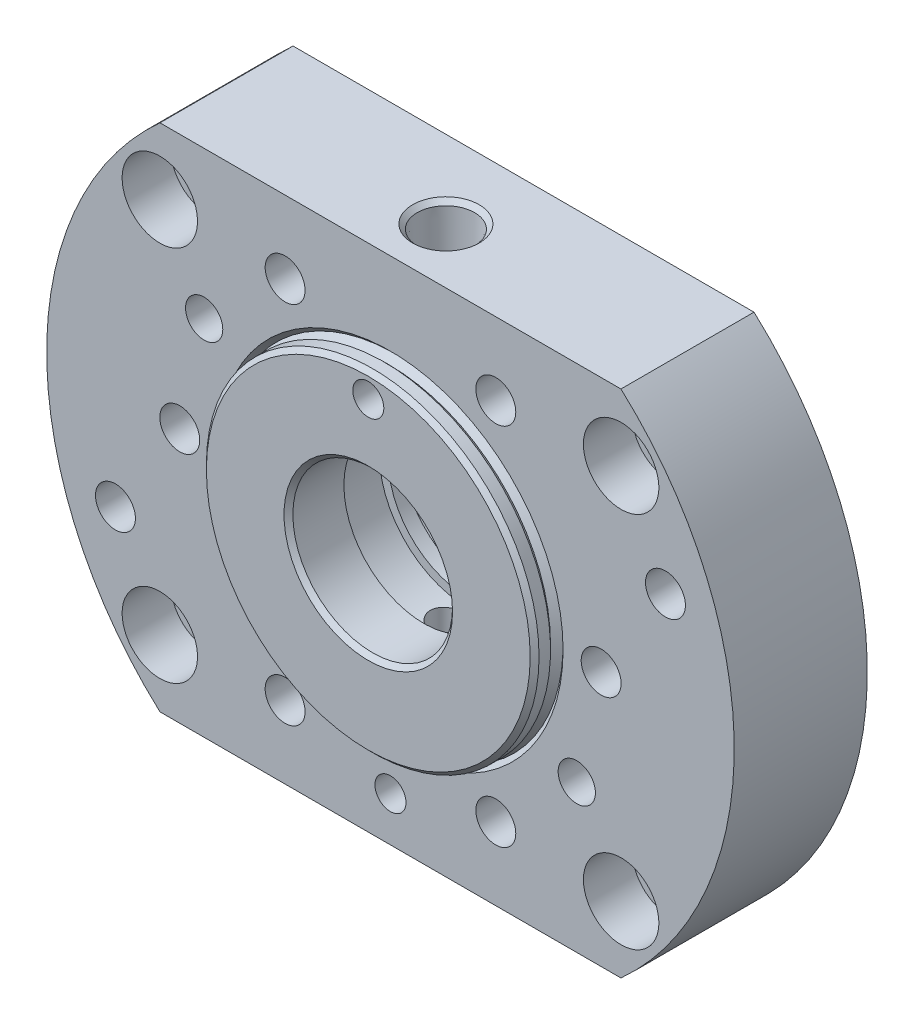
SolidWorks part; units mm, degrees
ref_plane "前视基准面" through (0, 0, 0) normal (0, 0, 1) x (1, 0, 0)
ref_plane "上视基准面" through (0, 0, 0) normal (0, 1, 0) x (1, 0, 0)
ref_plane "右视基准面" through (0, 0, 0) normal (1, 0, 0) x (0, 0, -1)
sketch "草图1" plane through (0, 0, 0) normal (1, 0, 0) x (0, 0, -1)
  line L0 (-1, 18) -> (-1, 35)
  line L1 (-1, 35) -> (0, 35)
  line L2 (0, 35) -> (0, 77.5)
  line L3 (0, 77.5) -> (-30, 77.5)
  line L4 (-30, 77.5) -> (-30, 38.9142)
  line L5 (-31.4142, 37.5) -> (-35, 37.5)
  line L6 (-35, 37.5) -> (-35, 18)
  line L7 (-35, 18) -> (-22.5, 18)
  line L8 (-22.5, 18) -> (-22.5, 20)
  line L9 (-22.5, 20) -> (-12.5, 20)
  line L10 (-12.5, 20) -> (-12.5, 18)
  line L11 (-12.5, 18) -> (-9.3, 18)
  line L12 (-9.3, 18) -> (-9.3, 21)
  line L13 (-9.3, 21) -> (-4.5, 21)
  line L14 (-4.5, 21) -> (-4.5, 18)
  line L15 (-4.5, 18) -> (-1, 18)
  line L16 (0, 0) -> (-40.0004, 0) construction
  line L17 (-17.5, 20) -> (-17.5, 6.4287) construction
  line L18 (-30, 38.9142) -> (-28.9393, 37.8536)
  line L19 (-28.9393, 37.8536) -> (-30.3536, 36.4393)
  line L20 (-30.3536, 36.4393) -> (-31.4142, 37.5)
  line L21 (-30, 37.5) -> (-39.6979, 47.1979) construction
  line L22 (-30, 38.9142) -> (-30, 37.5) construction
  line L23 (-30, 37.5) -> (-31.4142, 37.5) construction
  dimension "D1" = 36
  dimension "D2" = 40
  dimension "D3" = 42
  dimension "D4" = 155
  dimension "D5" = 75
  dimension "D6" = 70
  dimension "D7" = 5
  dimension "D8" = 10
  dimension "D9" = 1
  dimension "D10" = 4.8
  dimension "D11" = 3.5
  dimension "D12" = 35
  dimension "D13" = 12.5
  dimension "D14" = 2
  dimension "D15" = 1.5
  dimension "D16" = 45
revolve "旋转1" add sketch "草图1" angle 360 about L16
sketch "草图2" plane through (0, 0, 0) normal (0, 0, -1) x (-1, 0, 0)
  line L0 (0, 0) -> (0, -96.6864) construction
  line L1 (2.5, -27.7392) -> (-2.5, -27.7392)
  line L2 (2.5, -27.7392) -> (2.5, -84.8211)
  line L3 (2.5, -84.8211) -> (-2.5, -84.8211)
  line L4 (-2.5, -27.7392) -> (-2.5, -84.8211)
  dimension "D1" = 5
extrude "切除-拉伸1" cut sketch "草图2" against normal up to surface (1 mm away)
sketch "草图3" plane through (0, 0, 0) normal (0, 0, 1) x (1, 0, 0)
  line L0 (0, 0) -> (62.0525, 0) construction
  line L1 (-96.045, 96.6235) -> (66.8627, 96.6235)
  line L2 (-96.045, 96.6235) -> (-96.045, 57.5)
  line L3 (-96.045, 57.5) -> (66.8627, 57.5)
  line L4 (66.8627, 96.6235) -> (66.8627, 57.5)
  line L5 (66.8627, -96.6235) -> (66.8627, -57.5)
  line L6 (-96.045, -57.5) -> (66.8627, -57.5)
  line L7 (-96.045, -96.6235) -> (-96.045, -57.5)
  line L8 (-96.045, -96.6235) -> (66.8627, -96.6235)
  dimension "D1" = 115
extrude "切除-拉伸3" cut sketch "草图3" along normal through all
sketch "草图4" plane through (0, 0, 0) normal (1, 0, 0) x (0, 0, -1)
  line L0 (-17.5, 70.5589) -> (-17.5, -52.7009) construction
  line L1 (-30, 57.5) -> (-30, -57.5) construction
  line L2 (-12.5, 25.5) -> (-12.5, 42.5)
  line L3 (-12.5, 42.5) -> (-11.4688, 42.5)
  line L4 (-17.5, 57.5) -> (-17.5, -47.5)
  line L5 (-17.5, -47.5) -> (-14, -47.5)
  line L6 (-11.4688, 42.5) -> (-11, 57.5)
  line L7 (-12.5, 25.5) -> (-14, 24.634)
  line L8 (-14, 24.634) -> (-14, -47.5)
  line L9 (-11, 57.5) -> (-17.5, 57.5)
  line L10 (-30, 57.5) -> (0, 57.5) construction
  point P5 (-11.25, 49.5)
  dimension "D1" = 12.5
  dimension "D2" = 10
  dimension "D3" = 60
  dimension "D4" = 32
  dimension "D5" = 7
  dimension "D6" = 47.5
  dimension "D7" = 13
  dimension "D8" = 15
  dimension "D9" = 8
  dimension "D10" = 12.5
revolve "NPT1/4" cut sketch "草图4" angle 360 about L0
sketch "草图5" plane through (0, 0, 35) normal (0, 0, 1) x (1, 0, 0)
  line L0 (0, 0) -> (-14.1534, 0) construction
  circle A0 centre (0, 32) radius 3.5
  dimension "D2" = 7
  dimension "D1" = 32
extrude "切除-拉伸4" cut sketch "草图5" against normal up to surface (17.5 mm away)
sketch "草图7" plane through (0, 0, 30) normal (0, 0, -1) x (-1, 0, 0)
  line L0 (0, 0) -> (58.5979, 0) construction
  line L1 (0, 0) -> (-32.0903, 0) construction
  line L2 (0, 0) -> (0, 61.5079) construction
  line L3 (0, 0) -> (54.3791, 31.3958) construction
  line L4 (0, 0) -> (-56.7414, -32.7597) construction
  circle A0 centre (0, 0) radius 48.5 construction
  point P3 (42.0022, 24.25)
  point P5 (-42.0022, -24.25)
  dimension "D3" = 97
  dimension "D4" = 30
sketch "草图8" plane through (0, 0, 0) normal (0, 0, -1) x (-1, 0, 0)
  circle A0 centre (-47.5, 0) radius 4.5
  dimension "D2" = 9
  dimension "D1" = 47.5
extrude "切除-拉伸7" cut sketch "草图8" against normal through all
sketch "草图9" plane through (0, 0, 0) normal (0, 0, 1) x (1, 0, 0)
  circle A0 centre (47.5, 0) radius 7
  circle A1 centre (47.5, 0) radius 4.5 construction
  dimension "D1" = 14
extrude "切除-拉伸8" cut sketch "草图9" along normal blind 9
pattern_circular "阵列(圆周)1" count 6 over 360 about axis through (0, 0, 0) along (0, 0, 1) of "切除-拉伸8", "切除-拉伸7"
sketch "草图11" plane through (0, 0, 0) normal (0, 0, -1) x (-1, 0, 0)
  line L0 (0, 0) -> (10.7794, 0) construction
  line L1 (0, 0) -> (0, -9.2926) construction
  line L2 (0, 70.5589) -> (0, -52.7009) construction
  circle A0 centre (52, 42.5) radius 5.5
  circle A1 centre (-52, 42.5) radius 5.5
  circle A2 centre (-52, -42.5) radius 5.5
  circle A3 centre (52, -42.5) radius 5.5
  dimension "D1" = 11
  dimension "D2" = 85
  dimension "D3" = 104
extrude "切除-拉伸9" cut sketch "草图11" against normal through all
sketch "草图12" plane through (0, 0, 30) normal (0, 0, -1) x (-1, 0, 0)
  circle A0 centre (52, 42.5) radius 8.5
  circle A1 centre (-52, 42.5) radius 8.5
  circle A2 centre (-52, -42.5) radius 8.5
  circle A4 centre (52, 42.5) radius 5.5 construction
  circle A5 centre (-52, 42.5) radius 5.5 construction
  circle A6 centre (-52, -42.5) radius 5.5 construction
  circle A8 centre (52, -42.5) radius 8.5
  circle A9 centre (52, -42.5) radius 5.5 construction
  dimension "D1" = 17
extrude "切除-拉伸10" cut sketch "草图12" along normal blind 11
sketch "草图13" plane through (0, 0, 30) normal (0, 0, -1) x (-1, 0, 0)
  circle A2 centre (52, -42.5) radius 5.5 construction
  circle A3 centre (52, -42.5) radius 5.5 construction
  circle A4 centre (-52, 42.5) radius 5.5 construction
  circle A5 centre (-52, 42.5) radius 5.5 construction
chamfer "倒角1" distance 1 angle 45 3 edges at (-18, 0, 35) (-37.5, 0, 35) (-18, 0, 1)
sketch "草图15" plane through (0, 0, 0) normal (1, 0, 0) x (0, 0, -1)
  line L0 (-30, -51) -> (-13, -51)
  line L1 (-30, 57.5) -> (-30, -57.5) construction
  line L2 (-13, -51) -> (-10.9793, -47.5)
  line L3 (-10.9793, -47.5) -> (-30, -47.5)
  line L4 (-30, -47.5) -> (-30, -51)
  line L5 (-30, -47.5) -> (-36.6669, -47.5) construction
  line L6 (0, 0) -> (-13.7437, 0) construction
  dimension "D1" = 95
  dimension "D2" = 7
  dimension "D3" = 60
  dimension "D4" = 17
revolve "切除-旋转1" cut sketch "草图15" angle 360 about L5
ref_plane "基准面1" through (0, 24.25, 0) normal (0, 1, 0) x (-1, 0, 0)
sketch "草图16" plane through (0, 24.25, 0) normal (0, 1, 0) x (-1, 0, 0)
  line L0 (42.0022, 30) -> (42.0022, -14.6561) construction
  line L1 (42.0022, 0) -> (46.5022, 0)
  line L2 (51.9615, 0) -> (-51.9615, 0) construction
  line L3 (46.5022, 0) -> (46.2022, 30)
  line L4 (-48.5, 30) -> (48.5, 30) construction
  line L5 (46.2022, 30) -> (42.0022, 30)
  line L6 (42.0022, 30) -> (42.0022, 0)
  point P7 (46.2522, 25)
  dimension "D1" = 9
  dimension "D2" = 25
  dimension "D3" = 8.5
revolve "切除-旋转2" cut sketch "草图16" angle 360 about L0
ref_plane "基准面2" through (0, -24.25, 0) normal (0, 1, 0) x (-1, 0, 0)
sketch "草图17" plane through (0, -24.25, 0) normal (0, 1, 0) x (-1, 0, 0)
  line L0 (-42.0022, 30) -> (-42.0022, -3.4835) construction
  line L1 (-42.0022, 0) -> (-46.5022, 0)
  line L2 (51.9615, 0) -> (-51.9615, 0) construction
  line L3 (-46.5022, 0) -> (-46.2022, 30)
  line L4 (0, 30) -> (-56.7414, 30) construction
  line L5 (-46.2022, 30) -> (-42.0022, 30)
  line L6 (-42.0022, 30) -> (-42.0022, 0)
  point P9 (-46.2522, 25)
  dimension "D1" = 25
  dimension "D2" = 9
  dimension "D3" = 8.5
revolve "切除-旋转3" cut sketch "草图17" angle 360 about L0
sketch "草图18" plane through (0, 0, 30) normal (0, 0, 1) x (1, 0, 0)
  circle A0 centre (-52, -42.5) radius 5.5 construction
  circle A1 centre (52, 42.5) radius 5.5 construction
  circle A2 centre (-52, -42.5) radius 5.5 construction
  circle A3 centre (52, 42.5) radius 5.5 construction
  point P0 (62, 22.5)
  point P1 (-62, -22.5)
  dimension "D1" = 20
  dimension "D2" = 20
  dimension "D3" = 10
  dimension "D4" = 10
ref_plane "基准面4" through (0, -22.5, 0) normal (0, 1, 0) x (-1, 0, 0)
ref_plane "基准面3" through (0, 22.5, 0) normal (0, 1, 0) x (-1, 0, 0)
sketch "草图19" plane through (0, -22.5, 0) normal (0, 1, 0) x (-1, 0, 0)
  line L0 (62, 30) -> (62, -9.127) construction
  line L1 (62, 30) -> (66.5, 30)
  line L2 (77.5, 30) -> (51.9615, 30) construction
  line L3 (66.5, 30) -> (66.2, 0)
  line L4 (62, 0) -> (62, 30)
  line L6 (66.2, 0) -> (62, 0)
  line L7 (60.5, 30) -> (43.5, 30) construction
  line L8 (51.9615, 0) -> (77.5, 0) construction
  point P3 (66.25, 5)
  dimension "D1" = 9
  dimension "D2" = 25
  dimension "D3" = 8.5
revolve "切除-旋转4" cut sketch "草图19" angle 360 about L0
sketch "草图20" plane through (0, 22.5, 0) normal (0, 1, 0) x (-1, 0, 0)
  line L0 (-62, 30) -> (-62, 51.4021) construction
  line L1 (-62, 30) -> (-66.5, 30)
  line L2 (-51.9615, 30) -> (-77.5, 30) construction
  line L3 (-66.5, 30) -> (-66.2, 0)
  line L4 (-77.5, 0) -> (-51.9615, 0) construction
  line L5 (-66.2, 0) -> (-62, 0)
  line L6 (-62, 0) -> (-62, 30)
  point P3 (-66.25, 5)
  dimension "D1" = 9
  dimension "D2" = 8.5
  dimension "D3" = 25
revolve "切除-旋转5" cut sketch "草图20" angle 360 about L0
chamfer "倒角2" distance 1 angle 45 1 edges at (0, 57.5, 24)
sketch "草图21" plane through (0, 57.5, 0) normal (0, 1, 0) x (-1, 0, 0)
  line L0 (0, -11.7328) -> (0, 53.8757)
extrude "切除-拉伸11" cut sketch "草图21" along normal through all and the other way through all flip side to cut
